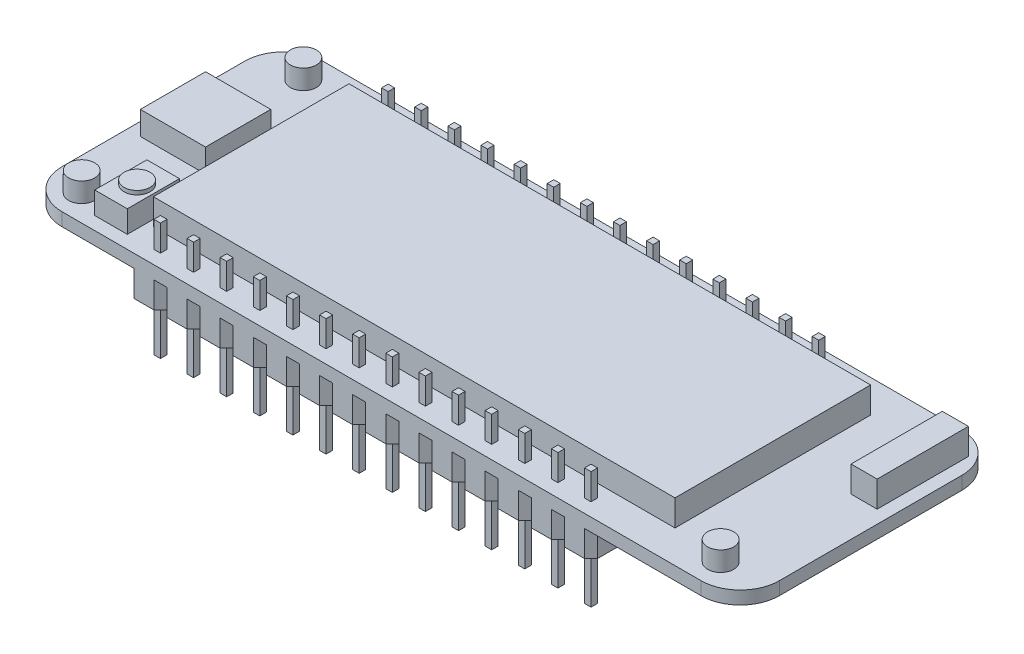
SolidWorks part; units mm, degrees
ref_plane "Front Plane" through (0, 0, 0) normal (0, 0, 1) x (1, 0, 0)
ref_plane "Top Plane" through (0, 0, 0) normal (0, 1, 0) x (1, 0, 0)
ref_plane "Right Plane" through (0, 0, 0) normal (1, 0, 0) x (0, 0, -1)
sketch "Sketch1" plane through (0, 0, 0) normal (0, 1, 0) x (1, 0, 0)
  line L1 (3, 0) -> (52, 0)
  line L2 (0, 3) -> (0, 17)
  line L3 (3, 20) -> (52, 20)
  line L4 (55, 3) -> (55, 17)
  arc A0 (52, 20) -> (55, 17) centre (52, 17) cw
  arc A1 (52, 0) -> (55, 3) centre (52, 3) ccw
  arc A2 (3, 0) -> (0, 3) centre (3, 3) cw
  arc A3 (0, 17) -> (3, 20) centre (3, 17) cw
  point P7 (55, 20)
  point P10 (55, 0)
  point P13 (0, 0)
  dimension "D3" = 3
  dimension "D1" = 55
  dimension "D2" = 20
extrude "Board" add sketch "Sketch1" along normal blind 1
sketch "Sketch2" plane through (0, 1, 0) normal (0, 1, 0) x (1, 0, 0)
  line L0 (52, 20) -> (3, 20) construction
  line L1 (7.5, 17.5) -> (47.5, 17.5)
  line L2 (7.5, 17.5) -> (7.5, 2.5)
  line L3 (7.5, 2.5) -> (47.5, 2.5)
  line L4 (47.5, 17.5) -> (47.5, 2.5)
  line L5 (55, 3) -> (55, 17) construction
  point P6 (27.5, 2.5)
  point P7 (27.5, 20)
  point P8 (47.5, 10)
  point P11 (55, 10)
  dimension "D1" = 40
  dimension "D2" = 15
extrude "LoPy4 chip" add sketch "Sketch2" along normal blind 2
sketch "Sketch3" plane through (0, 1, 0) normal (0, 1, 0) x (1, 0, 0)
  line L0 (55, 3) -> (55, 17) construction
  line L1 (52, 18.5) -> (54, 18.5)
  line L2 (52, 18.5) -> (52, 11.5)
  line L3 (52, 11.5) -> (54, 11.5)
  line L4 (54, 18.5) -> (54, 11.5)
  line L5 (52, 20) -> (3, 20) construction
  dimension "D1" = 7
  dimension "D2" = 2
  dimension "D3" = 1
  dimension "D4" = 1.5
extrude "Antenna" add sketch "Sketch3" along normal blind 2
sketch "Sketch4" plane through (0, 1, 0) normal (0, 1, 0) x (1, 0, 0)
  line L0 (3, 0) -> (52, 0) construction
  line L1 (6, 13) -> (1, 13)
  line L2 (6, 13) -> (6, 8)
  line L3 (6, 8) -> (1, 8)
  line L4 (1, 13) -> (1, 8)
  line L5 (0, 17) -> (0, 3) construction
  dimension "D1" = 5
  dimension "D2" = 5
  dimension "D3" = 8
  dimension "D4" = 1
extrude "LED" add sketch "Sketch4" along normal blind 1.8
sketch "Sketch5" plane through (0, 1, 0) normal (0, 1, 0) x (1, 0, 0)
  line L0 (0, 17) -> (0, 3) construction
  line L1 (4.5, 5) -> (7, 5)
  line L2 (4.5, 5) -> (4.5, 1)
  line L3 (4.5, 1) -> (7, 1)
  line L4 (7, 5) -> (7, 1)
  line L5 (3, 0) -> (52, 0) construction
  dimension "D1" = 4
  dimension "D2" = 2.5
  dimension "D3" = 4.5
  dimension "D4" = 1
extrude "Button base" add sketch "Sketch5" along normal blind 1.7
sketch "Sketch6" plane through (0, 2.7, 0) normal (0, 1, 0) x (1, 0, 0)
  line L0 (7, 5) -> (4.5, 5) construction
  line L1 (4.5, 5) -> (4.5, 1) construction
  circle A0 centre (5.75, 3) radius 1
  point P5 (5.75, 5)
  point P8 (4.5, 3)
  dimension "D1" = 2
extrude "Button" add sketch "Sketch6" along normal blind 0.3
sketch "Sketch7" plane through (0, 1, 0) normal (0, 1, 0) x (1, 0, 0)
  line L0 (3, 0) -> (52, 0) construction
  line L1 (55, 3) -> (55, 17) construction
  line L2 (0, 17) -> (0, 3) construction
  line L3 (52, 20) -> (3, 20) construction
  circle A0 centre (3.5, 18) radius 1
  circle A1 centre (2.5, 2) radius 1
  circle A2 centre (51.5, 2) radius 1
  dimension "D1" = 2
  dimension "D2" = 2
  dimension "D3" = 3.5
  dimension "D4" = 2.5
  dimension "D5" = 2
  dimension "D6" = 3.5
extrude "LoRa antennae" add sketch "Sketch7" along normal blind 1.5
sketch "Label" plane through (0, 3, 0) normal (0, 1, 0) x (1, 0, 0)
  text T0 "<b>lopy4</b>"
sketch "Sketch9" plane through (0, 0, 0) normal (0, -1, 0) x (-1, 0, 0)
  line L0 (-8, 0.5) -> (-8.5, 0)
  line L1 (-8.5, 0) -> (-10.04, 0)
  line L2 (-8, 0.5) -> (-8, 2.04)
  line L3 (-8.5, 2.54) -> (-10.04, 2.54)
  line L4 (-10.54, 0.5) -> (-10.54, 2.04)
  line L5 (-10.04, 0) -> (-10.54, 0.5)
  line L6 (-8, 2.04) -> (-8.5, 2.54)
  line L7 (-10.04, 2.54) -> (-10.54, 2.04)
  line L8 (-3, 0) -> (-52, 0) construction
  line L9 (0, 17) -> (0, 3) construction
  line L10 (-10.54, 0.5) -> (-10.54, 2.04)
  line L11 (-10.54, 2.04) -> (-11.04, 2.54)
  line L12 (-10.54, 0.5) -> (-11.04, 0)
  line L13 (-11.04, 0) -> (-12.58, 0)
  line L14 (-12.58, 0) -> (-13.08, 0.5)
  line L15 (-13.08, 0.5) -> (-13.08, 2.04)
  line L16 (-12.58, 2.54) -> (-13.08, 2.04)
  line L17 (-11.04, 2.54) -> (-12.58, 2.54)
  line L18 (-13.08, 0.5) -> (-13.08, 2.04)
  line L19 (-13.08, 2.04) -> (-13.58, 2.54)
  line L20 (-13.08, 0.5) -> (-13.58, 0)
  line L21 (-13.58, 0) -> (-15.12, 0)
  line L22 (-15.12, 0) -> (-15.62, 0.5)
  line L23 (-15.62, 0.5) -> (-15.62, 2.04)
  line L24 (-15.12, 2.54) -> (-15.62, 2.04)
  line L25 (-13.58, 2.54) -> (-15.12, 2.54)
  line L26 (-15.62, 0.5) -> (-15.62, 2.04)
  line L27 (-15.62, 2.04) -> (-16.12, 2.54)
  line L28 (-15.62, 0.5) -> (-16.12, 0)
  line L29 (-16.12, 0) -> (-17.66, 0)
  line L30 (-17.66, 0) -> (-18.16, 0.5)
  line L31 (-18.16, 0.5) -> (-18.16, 2.04)
  line L32 (-17.66, 2.54) -> (-18.16, 2.04)
  line L33 (-16.12, 2.54) -> (-17.66, 2.54)
  line L34 (-18.16, 0.5) -> (-18.16, 2.04)
  line L35 (-18.16, 2.04) -> (-18.66, 2.54)
  line L36 (-18.16, 0.5) -> (-18.66, 0)
  line L37 (-18.66, 0) -> (-20.2, 0)
  line L38 (-20.2, 0) -> (-20.7, 0.5)
  line L39 (-20.7, 0.5) -> (-20.7, 2.04)
  line L40 (-20.2, 2.54) -> (-20.7, 2.04)
  line L41 (-18.66, 2.54) -> (-20.2, 2.54)
  line L42 (-20.7, 0.5) -> (-20.7, 2.04)
  line L43 (-20.7, 2.04) -> (-21.2, 2.54)
  line L44 (-20.7, 0.5) -> (-21.2, 0)
  line L45 (-21.2, 0) -> (-22.74, 0)
  line L46 (-22.74, 0) -> (-23.24, 0.5)
  line L47 (-23.24, 0.5) -> (-23.24, 2.04)
  line L48 (-22.74, 2.54) -> (-23.24, 2.04)
  line L49 (-21.2, 2.54) -> (-22.74, 2.54)
  line L50 (-23.24, 0.5) -> (-23.24, 2.04)
  line L51 (-23.24, 2.04) -> (-23.74, 2.54)
  line L52 (-23.24, 0.5) -> (-23.74, 0)
  line L53 (-23.74, 0) -> (-25.28, 0)
  line L54 (-25.28, 0) -> (-25.78, 0.5)
  line L55 (-25.78, 0.5) -> (-25.78, 2.04)
  line L56 (-25.28, 2.54) -> (-25.78, 2.04)
  line L57 (-23.74, 2.54) -> (-25.28, 2.54)
  line L58 (-25.78, 0.5) -> (-25.78, 2.04)
  line L59 (-25.78, 2.04) -> (-26.28, 2.54)
  line L60 (-25.78, 0.5) -> (-26.28, 0)
  line L61 (-26.28, 0) -> (-27.82, 0)
  line L62 (-27.82, 0) -> (-28.32, 0.5)
  line L63 (-28.32, 0.5) -> (-28.32, 2.04)
  line L64 (-27.82, 2.54) -> (-28.32, 2.04)
  line L65 (-26.28, 2.54) -> (-27.82, 2.54)
  line L66 (-28.32, 0.5) -> (-28.32, 2.04)
  line L67 (-28.32, 2.04) -> (-28.82, 2.54)
  line L68 (-28.32, 0.5) -> (-28.82, 0)
  line L69 (-28.82, 0) -> (-30.36, 0)
  line L70 (-30.36, 0) -> (-30.86, 0.5)
  line L71 (-30.86, 0.5) -> (-30.86, 2.04)
  line L72 (-30.36, 2.54) -> (-30.86, 2.04)
  line L73 (-28.82, 2.54) -> (-30.36, 2.54)
  line L74 (-30.86, 0.5) -> (-30.86, 2.04)
  line L75 (-30.86, 2.04) -> (-31.36, 2.54)
  line L76 (-30.86, 0.5) -> (-31.36, 0)
  line L77 (-31.36, 0) -> (-32.9, 0)
  line L78 (-32.9, 0) -> (-33.4, 0.5)
  line L79 (-33.4, 0.5) -> (-33.4, 2.04)
  line L80 (-32.9, 2.54) -> (-33.4, 2.04)
  line L81 (-31.36, 2.54) -> (-32.9, 2.54)
  line L82 (-33.4, 0.5) -> (-33.4, 2.04)
  line L83 (-33.4, 2.04) -> (-33.9, 2.54)
  line L84 (-33.4, 0.5) -> (-33.9, 0)
  line L85 (-33.9, 0) -> (-35.44, 0)
  line L86 (-35.44, 0) -> (-35.94, 0.5)
  line L87 (-35.94, 0.5) -> (-35.94, 2.04)
  line L88 (-35.44, 2.54) -> (-35.94, 2.04)
  line L89 (-33.9, 2.54) -> (-35.44, 2.54)
  line L90 (-35.94, 0.5) -> (-35.94, 2.04)
  line L91 (-35.94, 2.04) -> (-36.44, 2.54)
  line L92 (-35.94, 0.5) -> (-36.44, 0)
  line L93 (-36.44, 0) -> (-37.98, 0)
  line L94 (-37.98, 0) -> (-38.48, 0.5)
  line L95 (-38.48, 0.5) -> (-38.48, 2.04)
  line L96 (-37.98, 2.54) -> (-38.48, 2.04)
  line L97 (-36.44, 2.54) -> (-37.98, 2.54)
  line L98 (-38.48, 0.5) -> (-38.48, 2.04)
  line L99 (-38.48, 2.04) -> (-38.98, 2.54)
  line L100 (-38.48, 0.5) -> (-38.98, 0)
  line L101 (-38.98, 0) -> (-40.52, 0)
  line L102 (-40.52, 0) -> (-41.02, 0.5)
  line L103 (-41.02, 0.5) -> (-41.02, 2.04)
  line L104 (-40.52, 2.54) -> (-41.02, 2.04)
  line L105 (-38.98, 2.54) -> (-40.52, 2.54)
  line L106 (-41.02, 0.5) -> (-41.02, 2.04)
  line L107 (-41.02, 2.04) -> (-41.52, 2.54)
  line L108 (-41.02, 0.5) -> (-41.52, 0)
  line L109 (-41.52, 0) -> (-43.06, 0)
  line L110 (-43.06, 0) -> (-43.56, 0.5)
  line L111 (-43.56, 0.5) -> (-43.56, 2.04)
  line L112 (-43.06, 2.54) -> (-43.56, 2.04)
  line L113 (-41.52, 2.54) -> (-43.06, 2.54)
  line L114 (-10.54, 17.96) -> (-10.54, 19.5)
  line L115 (-10.54, 19.5) -> (-11.04, 20)
  line L116 (-10.54, 17.96) -> (-11.04, 17.46)
  line L117 (-11.04, 17.46) -> (-12.58, 17.46)
  line L118 (-12.58, 17.46) -> (-13.08, 17.96)
  line L119 (-13.08, 17.96) -> (-13.08, 19.5)
  line L120 (-12.58, 20) -> (-13.08, 19.5)
  line L121 (-11.04, 20) -> (-12.58, 20)
  line L122 (-13.08, 17.96) -> (-13.08, 19.5)
  line L123 (-13.08, 19.5) -> (-13.58, 20)
  line L124 (-13.08, 17.96) -> (-13.58, 17.46)
  line L125 (-13.58, 17.46) -> (-15.12, 17.46)
  line L126 (-15.12, 17.46) -> (-15.62, 17.96)
  line L127 (-15.62, 17.96) -> (-15.62, 19.5)
  line L128 (-15.12, 20) -> (-15.62, 19.5)
  line L129 (-13.58, 20) -> (-15.12, 20)
  line L130 (-15.62, 17.96) -> (-15.62, 19.5)
  line L131 (-15.62, 19.5) -> (-16.12, 20)
  line L132 (-15.62, 17.96) -> (-16.12, 17.46)
  line L133 (-16.12, 17.46) -> (-17.66, 17.46)
  line L134 (-17.66, 17.46) -> (-18.16, 17.96)
  line L135 (-18.16, 17.96) -> (-18.16, 19.5)
  line L136 (-17.66, 20) -> (-18.16, 19.5)
  line L137 (-16.12, 20) -> (-17.66, 20)
  line L138 (-18.16, 17.96) -> (-18.16, 19.5)
  line L139 (-18.16, 19.5) -> (-18.66, 20)
  line L140 (-18.16, 17.96) -> (-18.66, 17.46)
  line L141 (-18.66, 17.46) -> (-20.2, 17.46)
  line L142 (-20.2, 17.46) -> (-20.7, 17.96)
  line L143 (-20.7, 17.96) -> (-20.7, 19.5)
  line L144 (-20.2, 20) -> (-20.7, 19.5)
  line L145 (-18.66, 20) -> (-20.2, 20)
  line L146 (-20.7, 17.96) -> (-20.7, 19.5)
  line L147 (-20.7, 19.5) -> (-21.2, 20)
  line L148 (-20.7, 17.96) -> (-21.2, 17.46)
  line L149 (-21.2, 17.46) -> (-22.74, 17.46)
  line L150 (-22.74, 17.46) -> (-23.24, 17.96)
  line L151 (-23.24, 17.96) -> (-23.24, 19.5)
  line L152 (-22.74, 20) -> (-23.24, 19.5)
  line L153 (-21.2, 20) -> (-22.74, 20)
  line L154 (-23.24, 17.96) -> (-23.24, 19.5)
  line L155 (-23.24, 19.5) -> (-23.74, 20)
  line L156 (-23.24, 17.96) -> (-23.74, 17.46)
  line L157 (-23.74, 17.46) -> (-25.28, 17.46)
  line L158 (-25.28, 17.46) -> (-25.78, 17.96)
  line L159 (-25.78, 17.96) -> (-25.78, 19.5)
  line L160 (-25.28, 20) -> (-25.78, 19.5)
  line L161 (-23.74, 20) -> (-25.28, 20)
  line L162 (-25.78, 17.96) -> (-25.78, 19.5)
  line L163 (-25.78, 19.5) -> (-26.28, 20)
  line L164 (-25.78, 17.96) -> (-26.28, 17.46)
  line L165 (-26.28, 17.46) -> (-27.82, 17.46)
  line L166 (-27.82, 17.46) -> (-28.32, 17.96)
  line L167 (-28.32, 17.96) -> (-28.32, 19.5)
  line L168 (-27.82, 20) -> (-28.32, 19.5)
  line L169 (-26.28, 20) -> (-27.82, 20)
  line L170 (-28.32, 17.96) -> (-28.32, 19.5)
  line L171 (-28.32, 19.5) -> (-28.82, 20)
  line L172 (-28.32, 17.96) -> (-28.82, 17.46)
  line L173 (-28.82, 17.46) -> (-30.36, 17.46)
  line L174 (-30.36, 17.46) -> (-30.86, 17.96)
  line L175 (-30.86, 17.96) -> (-30.86, 19.5)
  line L176 (-30.36, 20) -> (-30.86, 19.5)
  line L177 (-28.82, 20) -> (-30.36, 20)
  line L178 (-30.86, 17.96) -> (-30.86, 19.5)
  line L179 (-30.86, 19.5) -> (-31.36, 20)
  line L180 (-30.86, 17.96) -> (-31.36, 17.46)
  line L181 (-31.36, 17.46) -> (-32.9, 17.46)
  line L182 (-32.9, 17.46) -> (-33.4, 17.96)
  line L183 (-33.4, 17.96) -> (-33.4, 19.5)
  line L184 (-32.9, 20) -> (-33.4, 19.5)
  line L185 (-31.36, 20) -> (-32.9, 20)
  line L186 (-33.4, 17.96) -> (-33.4, 19.5)
  line L187 (-33.4, 19.5) -> (-33.9, 20)
  line L188 (-33.4, 17.96) -> (-33.9, 17.46)
  line L189 (-33.9, 17.46) -> (-35.44, 17.46)
  line L190 (-35.44, 17.46) -> (-35.94, 17.96)
  line L191 (-35.94, 17.96) -> (-35.94, 19.5)
  line L192 (-35.44, 20) -> (-35.94, 19.5)
  line L193 (-33.9, 20) -> (-35.44, 20)
  line L194 (-35.94, 17.96) -> (-35.94, 19.5)
  line L195 (-35.94, 19.5) -> (-36.44, 20)
  line L196 (-35.94, 17.96) -> (-36.44, 17.46)
  line L197 (-36.44, 17.46) -> (-37.98, 17.46)
  line L198 (-37.98, 17.46) -> (-38.48, 17.96)
  line L199 (-38.48, 17.96) -> (-38.48, 19.5)
  line L200 (-37.98, 20) -> (-38.48, 19.5)
  line L201 (-36.44, 20) -> (-37.98, 20)
  line L202 (-38.48, 17.96) -> (-38.48, 19.5)
  line L203 (-38.48, 19.5) -> (-38.98, 20)
  line L204 (-38.48, 17.96) -> (-38.98, 17.46)
  line L205 (-38.98, 17.46) -> (-40.52, 17.46)
  line L206 (-40.52, 17.46) -> (-41.02, 17.96)
  line L207 (-41.02, 17.96) -> (-41.02, 19.5)
  line L208 (-40.52, 20) -> (-41.02, 19.5)
  line L209 (-38.98, 20) -> (-40.52, 20)
  line L210 (-41.02, 17.96) -> (-41.02, 19.5)
  line L211 (-41.02, 19.5) -> (-41.52, 20)
  line L212 (-41.02, 17.96) -> (-41.52, 17.46)
  line L213 (-41.52, 17.46) -> (-43.06, 17.46)
  line L214 (-43.06, 17.46) -> (-43.56, 17.96)
  line L215 (-43.56, 17.96) -> (-43.56, 19.5)
  line L216 (-43.06, 20) -> (-43.56, 19.5)
  line L217 (-41.52, 20) -> (-43.06, 20)
  line L218 (-8, 17.96) -> (-8, 19.5)
  line L219 (-8, 19.5) -> (-8.5, 20)
  line L220 (-8, 17.96) -> (-8.5, 17.46)
  line L221 (-8.5, 17.46) -> (-10.04, 17.46)
  line L222 (-10.04, 17.46) -> (-10.54, 17.96)
  line L223 (-10.54, 17.96) -> (-10.54, 19.5)
  line L224 (-10.04, 20) -> (-10.54, 19.5)
  line L225 (-8.5, 20) -> (-10.04, 20)
  point P0 (-8, 0)
  point P1 (-10.54, 2.54)
  point P2 (-8, 2.54)
  point P3 (-10.54, 0)
  point P16 (-8, 1.27)
  dimension "D1" = 2.54
  dimension "D2" = 8
  dimension "D3" = 2.54
  dimension "D4" = 14
  dimension "D5" = 2
extrude "Header blocks" add sketch "Sketch9" along normal blind 2 contours L224 L114 L222 L221 L220 L218 L219 M16 | L120 L119 L118 L117 L116 L114 L115 M16 | L136 L135 L134 L133 L132 L127 L131 M16 | L144 L143 L142 L141 L140 L135 L139 M16 | L160 L159 L158 L157 L156 L151 L155 M16 | L168 L167 L166 L165 L164 L159 L163 M16 | L176 L175 L174 L173 L172 L167 L171 M16 | L184 L183 L182 L181 L180 L175 L179 M16 | L200 L199 L198 L197 L196 L191 L195 M16 | L216 L215 L214 L213 L212 L207 L211 M16 | L107 L113 L112 L111 L110 L108 L103 M12 | L91 L97 L96 L95 L94 L92 L87 M12 | L75 L81 L80 L79 L78 L76 L71 M12 | L67 L73 L72 L71 L70 L68 L63 M12 | L35 L41 L40 L39 L38 L36 L31 M12 | L27 L33 L32 L31 L30 L28 L23 M12 | L19 L25 L24 L23 L22 L20 L15 M12 | L11 L17 L16 L15 L14 L12 L4 M12 | L3 L7 L4 L5 L0 L2 L6 M12 | L52 L53 L54 L55 L56 L57 L51 L50 | L44 L45 L46 L47 L48 L49 L43 L42
sketch "Sketch10" plane through (0, 1, 0) normal (0, 1, 0) x (1, 0, 0)
  line L0 (3, 0) -> (52, 0) construction
  line L1 (9.02, 1.02) -> (9.52, 1.02)
  line L2 (9.02, 1.02) -> (9.02, 1.52)
  line L3 (9.02, 1.52) -> (9.52, 1.52)
  line L4 (9.52, 1.02) -> (9.52, 1.52)
  line L5 (8, 0.5) -> (8, 2.04) construction
  line L6 (11.56, 1.02) -> (11.56, 1.52)
  line L7 (11.56, 1.02) -> (12.06, 1.02)
  line L8 (12.06, 1.02) -> (12.06, 1.52)
  line L9 (11.56, 1.52) -> (12.06, 1.52)
  line L10 (14.1, 1.02) -> (14.1, 1.52)
  line L11 (14.1, 1.02) -> (14.6, 1.02)
  line L12 (14.6, 1.02) -> (14.6, 1.52)
  line L13 (14.1, 1.52) -> (14.6, 1.52)
  line L14 (16.64, 1.02) -> (16.64, 1.52)
  line L15 (16.64, 1.02) -> (17.14, 1.02)
  line L16 (17.14, 1.02) -> (17.14, 1.52)
  line L17 (16.64, 1.52) -> (17.14, 1.52)
  line L18 (19.18, 1.02) -> (19.18, 1.52)
  line L19 (19.18, 1.02) -> (19.68, 1.02)
  line L20 (19.68, 1.02) -> (19.68, 1.52)
  line L21 (19.18, 1.52) -> (19.68, 1.52)
  line L22 (21.72, 1.02) -> (21.72, 1.52)
  line L23 (21.72, 1.02) -> (22.22, 1.02)
  line L24 (22.22, 1.02) -> (22.22, 1.52)
  line L25 (21.72, 1.52) -> (22.22, 1.52)
  line L26 (24.26, 1.02) -> (24.26, 1.52)
  line L27 (24.26, 1.02) -> (24.76, 1.02)
  line L28 (24.76, 1.02) -> (24.76, 1.52)
  line L29 (24.26, 1.52) -> (24.76, 1.52)
  line L30 (26.8, 1.02) -> (26.8, 1.52)
  line L31 (26.8, 1.02) -> (27.3, 1.02)
  line L32 (27.3, 1.02) -> (27.3, 1.52)
  line L33 (26.8, 1.52) -> (27.3, 1.52)
  line L34 (29.34, 1.02) -> (29.34, 1.52)
  line L35 (29.34, 1.02) -> (29.84, 1.02)
  line L36 (29.84, 1.02) -> (29.84, 1.52)
  line L37 (29.34, 1.52) -> (29.84, 1.52)
  line L38 (31.88, 1.02) -> (31.88, 1.52)
  line L39 (31.88, 1.02) -> (32.38, 1.02)
  line L40 (32.38, 1.02) -> (32.38, 1.52)
  line L41 (31.88, 1.52) -> (32.38, 1.52)
  line L42 (34.42, 1.02) -> (34.42, 1.52)
  line L43 (34.42, 1.02) -> (34.92, 1.02)
  line L44 (34.92, 1.02) -> (34.92, 1.52)
  line L45 (34.42, 1.52) -> (34.92, 1.52)
  line L46 (36.96, 1.02) -> (36.96, 1.52)
  line L47 (36.96, 1.02) -> (37.46, 1.02)
  line L48 (37.46, 1.02) -> (37.46, 1.52)
  line L49 (36.96, 1.52) -> (37.46, 1.52)
  line L50 (39.5, 1.02) -> (39.5, 1.52)
  line L51 (39.5, 1.02) -> (40, 1.02)
  line L52 (40, 1.02) -> (40, 1.52)
  line L53 (39.5, 1.52) -> (40, 1.52)
  line L54 (42.04, 1.02) -> (42.04, 1.52)
  line L55 (42.04, 1.02) -> (42.54, 1.02)
  line L56 (42.54, 1.02) -> (42.54, 1.52)
  line L57 (42.04, 1.52) -> (42.54, 1.52)
  line L58 (11.56, 18.48) -> (11.56, 18.98)
  line L59 (11.56, 18.48) -> (12.06, 18.48)
  line L60 (12.06, 18.48) -> (12.06, 18.98)
  line L61 (11.56, 18.98) -> (12.06, 18.98)
  line L62 (14.1, 18.48) -> (14.1, 18.98)
  line L63 (14.1, 18.48) -> (14.6, 18.48)
  line L64 (14.6, 18.48) -> (14.6, 18.98)
  line L65 (14.1, 18.98) -> (14.6, 18.98)
  line L66 (16.64, 18.48) -> (16.64, 18.98)
  line L67 (16.64, 18.48) -> (17.14, 18.48)
  line L68 (17.14, 18.48) -> (17.14, 18.98)
  line L69 (16.64, 18.98) -> (17.14, 18.98)
  line L70 (19.18, 18.48) -> (19.18, 18.98)
  line L71 (19.18, 18.48) -> (19.68, 18.48)
  line L72 (19.68, 18.48) -> (19.68, 18.98)
  line L73 (19.18, 18.98) -> (19.68, 18.98)
  line L74 (21.72, 18.48) -> (21.72, 18.98)
  line L75 (21.72, 18.48) -> (22.22, 18.48)
  line L76 (22.22, 18.48) -> (22.22, 18.98)
  line L77 (21.72, 18.98) -> (22.22, 18.98)
  line L78 (24.26, 18.48) -> (24.26, 18.98)
  line L79 (24.26, 18.48) -> (24.76, 18.48)
  line L80 (24.76, 18.48) -> (24.76, 18.98)
  line L81 (24.26, 18.98) -> (24.76, 18.98)
  line L82 (26.8, 18.48) -> (26.8, 18.98)
  line L83 (26.8, 18.48) -> (27.3, 18.48)
  line L84 (27.3, 18.48) -> (27.3, 18.98)
  line L85 (26.8, 18.98) -> (27.3, 18.98)
  line L86 (29.34, 18.48) -> (29.34, 18.98)
  line L87 (29.34, 18.48) -> (29.84, 18.48)
  line L88 (29.84, 18.48) -> (29.84, 18.98)
  line L89 (29.34, 18.98) -> (29.84, 18.98)
  line L90 (31.88, 18.48) -> (31.88, 18.98)
  line L91 (31.88, 18.48) -> (32.38, 18.48)
  line L92 (32.38, 18.48) -> (32.38, 18.98)
  line L93 (31.88, 18.98) -> (32.38, 18.98)
  line L94 (34.42, 18.48) -> (34.42, 18.98)
  line L95 (34.42, 18.48) -> (34.92, 18.48)
  line L96 (34.92, 18.48) -> (34.92, 18.98)
  line L97 (34.42, 18.98) -> (34.92, 18.98)
  line L98 (36.96, 18.48) -> (36.96, 18.98)
  line L99 (36.96, 18.48) -> (37.46, 18.48)
  line L100 (37.46, 18.48) -> (37.46, 18.98)
  line L101 (36.96, 18.98) -> (37.46, 18.98)
  line L102 (39.5, 18.48) -> (39.5, 18.98)
  line L103 (39.5, 18.48) -> (40, 18.48)
  line L104 (40, 18.48) -> (40, 18.98)
  line L105 (39.5, 18.98) -> (40, 18.98)
  line L106 (42.04, 18.48) -> (42.04, 18.98)
  line L107 (42.04, 18.48) -> (42.54, 18.48)
  line L108 (42.54, 18.48) -> (42.54, 18.98)
  line L109 (42.04, 18.98) -> (42.54, 18.98)
  line L110 (9.02, 18.48) -> (9.02, 18.98)
  line L111 (9.02, 18.48) -> (9.52, 18.48)
  line L112 (9.52, 18.48) -> (9.52, 18.98)
  line L113 (9.02, 18.98) -> (9.52, 18.98)
  point P4 (9.02, 1.27)
  point P9 (9.27, 1.02)
  dimension "D1" = 0.5
  dimension "D2" = 0.5
  dimension "D3" = 1.27
  dimension "D4" = 1.27
  dimension "D5" = 14
  dimension "D6" = 2
extrude "Boss-Extrude9" add sketch "Sketch10" along normal blind 2 and the other way blind 7
